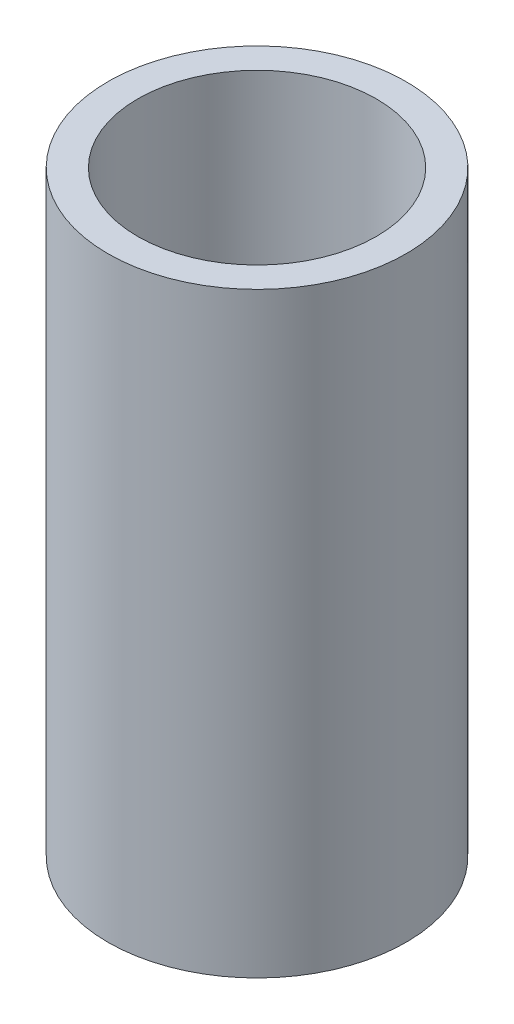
SolidWorks part; units mm, degrees
ref_plane "Front" through (0, 0, 0) normal (0, 0, 1) x (1, 0, 0)
ref_plane "Top" through (0, 0, 0) normal (0, 1, 0) x (1, 0, 0)
ref_plane "Right" through (0, 0, 0) normal (1, 0, 0) x (0, 0, -1)
sketch "Sketch1" plane through (0, 0, 0) normal (0, 1, 0) x (1, 0, 0)
  circle A0 centre (0, 0) radius 25
  circle A1 centre (0, 0) radius 20
  dimension "D1" = 50
  dimension "D2" = 40
extrude "Extrude1" add sketch "Sketch1" along normal blind 100
